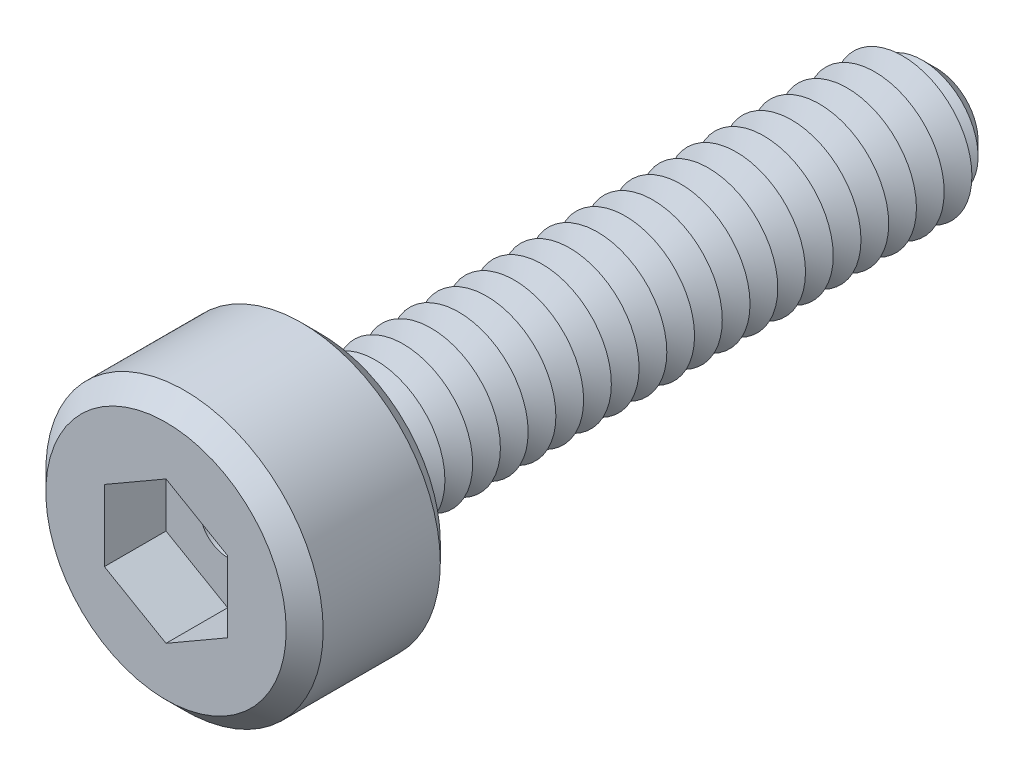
SolidWorks part; units mm, degrees
ref_plane "Front Plane" through (0, 0, 0) normal (0, 0, 1) x (1, 0, 0)
ref_plane "Top Plane" through (0, 0, 0) normal (0, 1, 0) x (1, 0, 0)
ref_plane "Right Plane" through (0, 0, 0) normal (1, 0, 0) x (0, 0, -1)
sketch "Sketch1" plane through (0, 0, 0) normal (0, 0, 1) x (1, 0, 0)
  circle A0 centre (0, 0) radius 2.25
  dimension "D1" = 4.5
extrude "Boss-Extrude1" add sketch "Sketch1" along normal blind 2.5
sketch "Sketch2" plane through (0, 0, 0) normal (0, 0, -1) x (-1, 0, 0)
  circle A0 centre (0, 0) radius 1.125
  dimension "D1" = 2.25
extrude "Boss-Extrude2" add sketch "Sketch2" along normal blind 10
chamfer "Chamfer1" distance 0.45 angle 45 1 edges at (-1.125, 0, -10)
sketch "Sketch3" plane through (0, 0, 0) normal (1, 0, 0) x (0, 0, -1)
  line L0 (-2.5121, 0) -> (4.5776, 0) construction
sketch "Sketch4" plane through (0, 0, 0) normal (1, 0, 0) x (0, 0, -1)
  line L0 (0, 1.125) -> (0.225, 0.7353)
  line L1 (0.225, 0.7353) -> (0.45, 1.125)
  line L2 (9.55, 1.125) -> (0, 1.125) construction
  line L3 (0.45, 1.125) -> (0, 1.125)
  dimension "D1" = 0.45
revolve "Cut-Revolve1" cut sketch "Sketch4" angle 360 about L0
pattern_linear "LPattern1" count 22 spacing 0.45 along (0, 0, -1) of "Cut-Revolve1"
sketch "Sketch5" plane through (0, 0, 2.5) normal (0, 0, 1) x (1, 0, 0)
  line L1 (0, 1.1547) -> (-1, 0.5774)
  line L2 (-1, 0.5774) -> (-1, -0.5774)
  line L3 (-1, -0.5774) -> (0, -1.1547)
  line L4 (0, -1.1547) -> (1, -0.5774)
  line L5 (1, -0.5774) -> (1, 0.5774)
  line L6 (1, 0.5774) -> (0, 1.1547)
  circle A0 centre (0, 0) radius 1 construction
  dimension "D1" = 2
extrude "Cut-Extrude1" cut sketch "Sketch5" against normal blind 1
sketch "Sketch6" plane through (0, 0, 1.5) normal (0, 0, 1) x (1, 0, 0)
  circle A0 centre (0, 0) radius 0.45
  dimension "D1" = 0.9
extrude "Cut-Extrude2" cut sketch "Sketch6" against normal up to surface (11.5 mm away)
chamfer "Chamfer2" distance 0.3 angle 45 2 edges at (2.25, 0, 0) (2.25, 0, 2.5)
